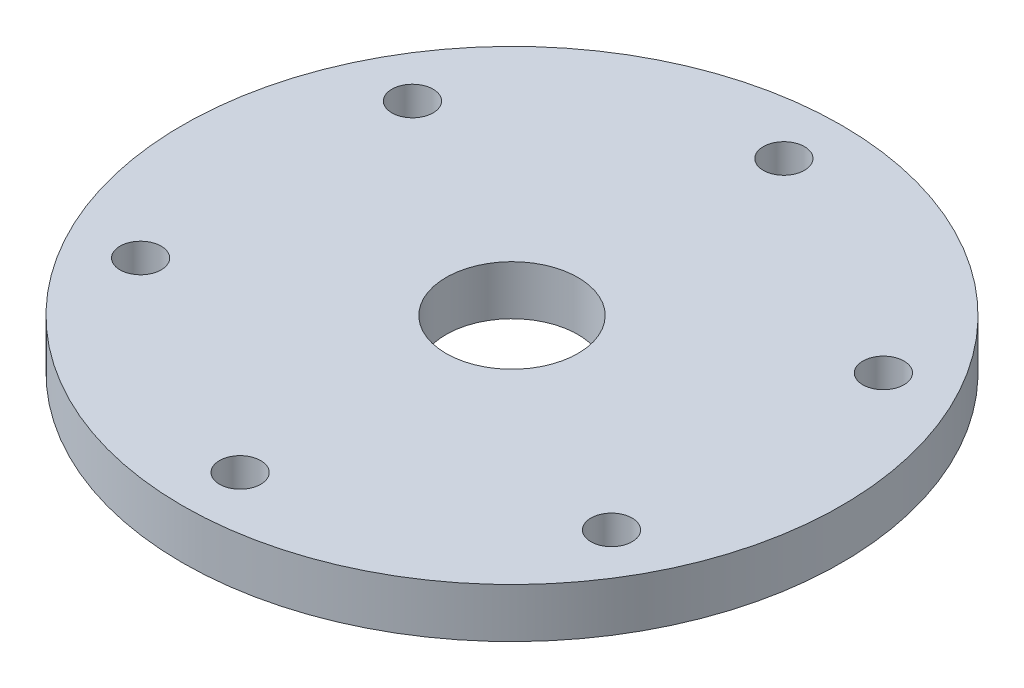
SolidWorks part; units mm, degrees
ref_plane "FRONT" through (0, 0, 0) normal (0, 0, 1) x (1, 0, 0)
ref_plane "TOP" through (0, 0, 0) normal (0, 1, 0) x (1, 0, 0)
ref_plane "RT-SIDE" through (0, 0, 0) normal (1, 0, 0) x (0, 0, -1)
sketch "Sketch1" plane through (0, 0, 0) normal (0, 1, 0) x (1, 0, 0)
  circle A0 centre (0, 0) radius 63.5
  dimension "D1" = 127
extrude "Base-Extrude" add sketch "Sketch1" against normal blind 9.525
sketch "Sketch2" plane through (-1.9947, 0, -2.0442) normal (0, 1, 0) x (-1, 0, 0)
  line L0 (-1.9947, 2.0442) -> (-1.9947, 54.4317) construction
  line L1 (-1.9947, 2.0442) -> (42.4553, 2.0442) construction
  circle A0 centre (-1.9947, 2.0442) radius 52.3875 construction
  circle A1 centre (-1.9947, 54.4317) radius 3.9688
  dimension "D1" = 104.775
  dimension "D2" = 7.9375
extrude "Cut-Extrude1" cut sketch "Sketch2" against normal through all
pattern_circular "CirPattern1" count 6 over 360 about axis through (0, 0, 0) along (0, 1, 0) of "Cut-Extrude1"
hole_wizard "Hole1" positions "Sketch35" profile "Sketch34" hole size "1" standard "Ansi Inch"
sketch "Sketch35" plane through (5.2606, 0, -0.858) normal (0, 1, 0) x (-1, 0, 0)
  line L0 (5.2606, 0.858) -> (5.2606, 39.1826) construction
  line L1 (5.2606, 0.858) -> (35.5041, 0.858) construction
  point P0 (5.2606, 0.858)
sketch "Sketch34" plane through (0, 0, 0) normal (1, 0, 0) x (0, 0, 1)
  line L0 (0, 0) -> (0, 33.0309)
  line L1 (0, 33.0309) -> (12.7, 25.4)
  line L2 (12.7, 25.4) -> (12.7, 0)
  line L5 (12.7, 0) -> (0, 0)
  line L10 (0, 33.0309) -> (-12.7, 25.4) construction
  line L11 (0, -6.35) -> (0, 107.95) construction
  dimension "Hole Dia." = 25.4
  dimension "Hole Depth" = 25.4
  dimension "Drill Angle" = 118
